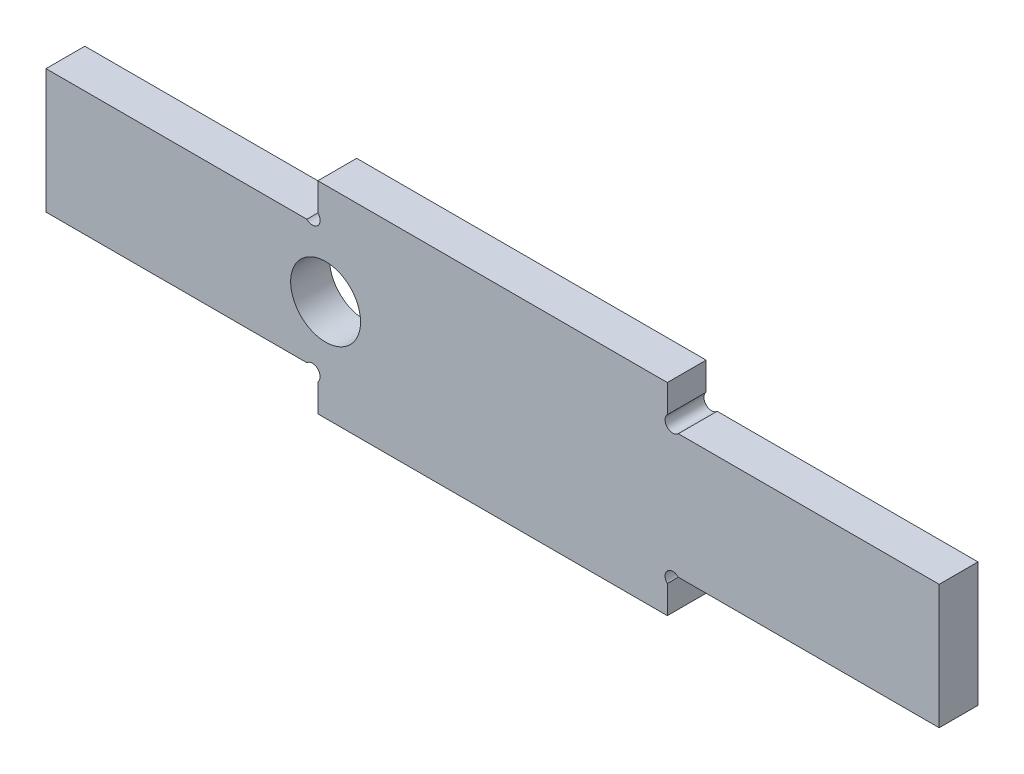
SolidWorks part; units mm, degrees
ref_plane "Plan de face" through (0, 0, 0) normal (0, 0, 1) x (1, 0, 0)
ref_plane "Plan de dessus" through (0, 0, 0) normal (0, 1, 0) x (1, 0, 0)
ref_plane "Plan de droite" through (0, 0, 0) normal (1, 0, 0) x (0, 0, -1)
sketch "Esquisse1" plane through (0, 0, 0) normal (0, 0, 1) x (1, 0, 0)
  line L1 (0, 0) -> (57.5, 0)
  line L2 (0, 0) -> (0, 26)
  line L3 (0, 26) -> (57.5, 26)
  line L4 (57.5, 0) -> (57.5, 26)
  dimension "D1" = 26
  dimension "D2" = 57.5
extrude "Boss.-Extru.1" add sketch "Esquisse1" along normal blind 5
sketch "Esquisse3" plane through (0, 0, 5) normal (0, 0, 1) x (1, 0, 0)
  line L1 (0, 26) -> (35, 26)
  line L2 (0, 26) -> (0, 21)
  line L3 (0, 21) -> (35, 21)
  line L4 (35, 26) -> (35, 21)
  line L5 (0, 0) -> (35, 0)
  line L6 (0, 0) -> (0, 5)
  line L7 (0, 5) -> (35, 5)
  line L8 (35, 0) -> (35, 5)
  dimension "D1" = 5
  dimension "D2" = 5
  dimension "D3" = 35
  dimension "D4" = 35
extrude "Enlèv. mat.-Extru.1" cut sketch "Esquisse3" against normal up to next
sketch "Esquisse5" plane through (0, 0, 5) normal (0, 0, 1) x (1, 0, 0)
  line L0 (35, 21) -> (26.1094, 29.8906) construction
  line L1 (35, 5) -> (27.6179, -2.3821) construction
  line L2 (0, 21) -> (35, 21) construction
  line L3 (35, 5) -> (0, 5) construction
  circle A0 centre (34.2929, 21.7071) radius 1
  circle A1 centre (34.2929, 4.2929) radius 1
  dimension "D3" = 2
  dimension "D4" = 2
  dimension "D1" = 45
  dimension "D2" = 45
extrude "Enlèv. mat.-Extru.3" cut sketch "Esquisse5" against normal up to next
mirror "Symétrie1" about plane through (57.5, 0, 5) normal (-1, 0, 0) of "Enlèv. mat.-Extru.3", "Enlèv. mat.-Extru.1", "Boss.-Extru.1"
sketch "Esquisse4" plane through (0, 0, 5) normal (0, 0, 1) x (1, 0, 0)
  line L0 (0, 21) -> (0, 5) construction
  line L1 (80, 26) -> (35, 26) construction
  circle A0 centre (36, 13) radius 4.5
  dimension "D1" = 9
  dimension "D2" = 36
  dimension "D3" = 13
extrude "Enlèv. mat.-Extru.2" cut sketch "Esquisse4" against normal up to next
